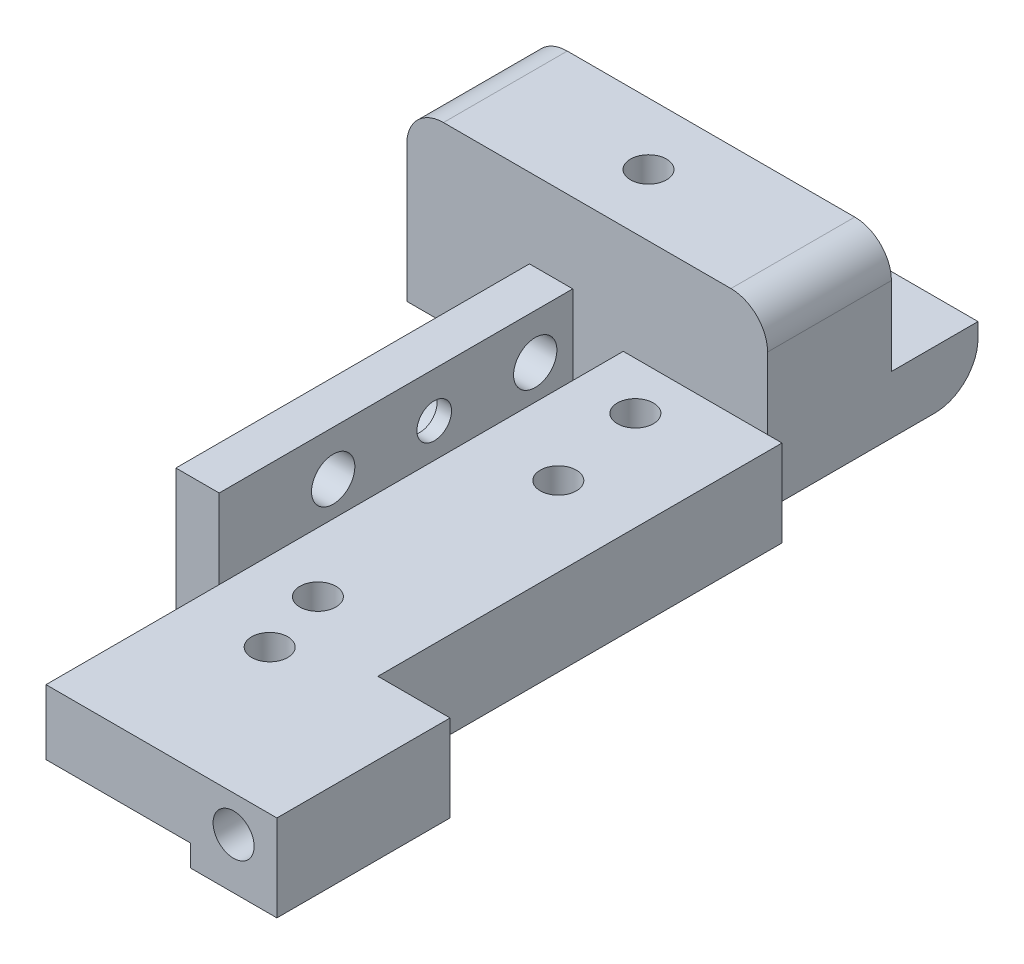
SolidWorks part; units mm, degrees
ref_plane "Front Plane" through (0, 0, 0) normal (0, 0, 1) x (1, 0, 0)
ref_plane "Top Plane" through (0, 0, 0) normal (0, 1, 0) x (1, 0, 0)
ref_plane "Right Plane" through (0, 0, 0) normal (1, 0, 0) x (0, 0, -1)
sketch "Sketch1" plane through (0, 0, 0) normal (0, 1, 0) x (1, 0, 0)
  line L0 (0, 0) -> (0, -40)
  line L1 (0, -40) -> (11, -40)
  line L2 (11, -40) -> (11, 0)
  line L5 (11, 0) -> (0, 0)
  dimension "D1" = 40
  dimension "D3" = 11
extrude "Boss-Extrude1" add sketch "Sketch1" along normal blind 4.5
sketch "Sketch2" plane through (0, 0, 0) normal (0, -1, 0) x (1, 0, 0)
  line L0 (11, 0) -> (0, 0) construction
  line L1 (10, 40) -> (11, 40)
  line L2 (10, 40) -> (10, 0)
  line L3 (10, 0) -> (11, 0)
  line L4 (11, 40) -> (11, 0)
  dimension "D1" = 1
extrude "Boss-Extrude2" add sketch "Sketch2" along normal blind 2
hole_wizard "M3x0.5 Tapped Hole1" positions "Sketch6" profile "Sketch5" tap size "M3x0.5" standard "ANSI Metric"
sketch "Sketch6" plane through (0, 0, 0) normal (0, -1, 0) x (-1, 0, 0)
  line L0 (-5.5, -40) -> (-5.5, 0) construction
  line L2 (-10, 0) -> (0, 0) construction
  line L3 (-10, 0) -> (0, 0) construction
  line L4 (0, -40) -> (-10, -40) construction
  line L5 (-10, -40) -> (-10, 0) construction
  point P0 (-5.5, -10)
  point P2 (-5.5, -30)
  dimension "D1" = 10
  dimension "D2" = 20
  dimension "D3" = 4.5
sketch "Sketch5" plane through (5.5, 0, 10) normal (1, 0, 0) x (0, 0, -1)
  line L0 (0, 0) -> (0, 9.2511)
  line L1 (0, 9.2511) -> (1.25, 8.5)
  line L2 (1.25, 8.5) -> (1.25, 0)
  line L5 (1.25, 0) -> (0, 0)
  line L10 (0, 9.2511) -> (-1.25, 8.5) construction
  line L11 (0, -6.35) -> (0, 107.95) construction
  dimension "Tap Drill Dia." = 2.5
  dimension "Tap Drill Depth" = 8.5
  dimension "Drill Angle" = 118
sketch "Sketch8" plane through (0, 0, 0) normal (0, 0, -1) x (-1, 0, 0)
  line L0 (-10, 0) -> (0, 0) construction
  line L1 (15, 0) -> (-10, 0)
  line L2 (15, 0) -> (15, 12)
  line L3 (15, 12) -> (-10, 12)
  line L4 (-11, 4.5) -> (-11, -2) construction
  line L6 (-10, 0) -> (-10, 12)
  dimension "D1" = 1
  dimension "D2" = 25
  dimension "D3" = 12
extrude "Boss-Extrude4" add sketch "Sketch8" along normal blind 8.58
hole_wizard "M3x0.5 Tapped Hole2" positions "Sketch10" profile "Sketch9" tap size "M3x0.5" standard "ANSI Metric"
sketch "Sketch10" plane through (0, 4.5, 0) normal (0, 1, 0) x (-1, 0, 0)
  line L0 (-4.14, 0) -> (-4.14, 40) construction
  line L1 (-10, 0) -> (0, 0) construction
  line L9 (-10, 40) -> (-10, 0) construction
  point P0 (-4.14, 3.3)
  point P2 (-4.14, 25.3)
  dimension "D1" = 3.3
  dimension "D2" = 22
  dimension "D3" = 5.86
sketch "Sketch9" plane through (4.14, 4.5, 3.3) normal (1, 0, 0) x (0, 0, 1)
  line L0 (0, 0) -> (0, 9.2511)
  line L1 (0, 9.2511) -> (1.25, 8.5)
  line L2 (1.25, 8.5) -> (1.25, 0)
  line L5 (1.25, 0) -> (0, 0)
  line L10 (0, 9.2511) -> (-1.25, 8.5) construction
  line L11 (0, -6.35) -> (0, 107.95) construction
  dimension "Tap Drill Dia." = 2.5
  dimension "Tap Drill Depth" = 8.5
  dimension "Drill Angle" = 118
sketch "Sketch11" plane through (0, 0, 0) normal (1, 0, 0) x (0, 0, -1)
  line L0 (-40, 4.5) -> (-40, -2) construction
  line L1 (-28, 0) -> (-3.5, 0)
  line L2 (-28, 0) -> (-28, 10)
  line L3 (-28, 10) -> (-3.5, 10)
  line L4 (-3.5, 0) -> (-3.5, 10)
  line L6 (-40, 0) -> (0, 0) construction
  line L7 (0, 12) -> (0, 4.5) construction
  dimension "D1" = 10
  dimension "D2" = 12
  dimension "D3" = 3.5
extrude "Boss-Extrude5" add sketch "Sketch11" against normal blind 3
sketch "Sketch12" plane through (0, 0, -8.58) normal (0, 0, -1) x (-1, 0, 0)
  line L0 (15, 0) -> (15, 12) construction
  line L1 (-10, 4) -> (15, 4)
  line L2 (-10, 4) -> (-10, 0)
  line L3 (-10, 0) -> (15, 0)
  line L4 (15, 4) -> (15, 0)
  line L6 (-10, 12) -> (-10, 0) construction
  line L7 (-10, 0) -> (15, 0) construction
  dimension "D1" = 4
extrude "Boss-Extrude6" add sketch "Sketch12" along normal blind 6
fillet "Fillet1" radius 3 1 edges at (-2.5, 0, -14.58)
hole_wizard "M3x0.5 Tapped Hole4" positions "Sketch17" profile "Sketch16" tap size "M3x0.5" standard "ANSI Metric"
sketch "Sketch17" plane through (0, 0, -8.58) normal (0, 0, -1) x (-1, 0, 0)
  line L0 (2.5, 12) -> (2.5, 0) construction
  line L1 (15, 12) -> (-10, 12) construction
  line L2 (15, 0) -> (-10, 0) construction
  line L4 (-10, 8) -> (-5.5, 8) construction
  line L6 (-10, 12) -> (-10, 4) construction
  point P0 (-5.5, 8)
  point P16 (10.5, 8)
  dimension "D1" = 16
sketch "Sketch16" plane through (5.5, 8, -8.58) normal (1, 0, 0) x (0, 1, 0)
  line L0 (0, 0) -> (0, 8.2511)
  line L1 (0, 8.2511) -> (1.25, 7.5)
  line L2 (1.25, 7.5) -> (1.25, 0)
  line L5 (1.25, 0) -> (0, 0)
  line L10 (0, 8.2511) -> (-1.25, 7.5) construction
  line L11 (0, -6.35) -> (0, 107.95) construction
  dimension "Tap Drill Dia." = 2.5
  dimension "Tap Drill Depth" = 7.5
  dimension "Drill Angle" = 118
sketch "Sketch18" plane through (0, 0, -8.58) normal (0, 0, -1) x (-1, 0, 0)
  line L0 (-5.5, 8) -> (10.5, 8) construction
  circle A0 centre (6.5, 8) radius 1.5
  circle A1 centre (-5.5, 8) radius 1.25 construction
  dimension "D1" = 3
  dimension "D2" = 12
extrude "Cut-Extrude1" [suppressed] cut sketch "Sketch18" against normal up to next
sketch "Sketch19" plane through (0, 4.5, 0) normal (0, 1, 0) x (1, 0, 0)
  line L0 (11, -40) -> (16, -40)
  line L1 (16, -40) -> (16, -28)
  line L2 (16, -28) -> (11, -28)
  line L3 (11, -40) -> (11, 0) construction
  line L4 (11, -28) -> (11, -40)
  dimension "D1" = 5
  dimension "D2" = 12
extrude "Boss-Extrude7" add sketch "Sketch19" against normal up to surface (6.5 mm away)
hole_wizard "#4-40 Tapped Hole1" positions "Sketch22" profile "Sketch21" tap size "#4-40" standard "ANSI Inch"
sketch "Sketch22" plane through (0, 0, 40) normal (0, 0, 1) x (1, 0, 0)
  line L1 (16, -2) -> (10, -2) construction
  line L2 (10, -2) -> (10, 0) construction
  point P0 (13, 2)
  dimension "D1" = 3
  dimension "D2" = 4
sketch "Sketch21" plane through (13, 2, 40) normal (1, 0, 0) x (0, -1, 0)
  line L0 (0, 0) -> (0, 9.5492)
  line L1 (0, 9.5492) -> (1.1303, 8.87)
  line L2 (1.1303, 8.87) -> (1.1303, 5.69)
  line L3 (1.1303, 5.69) -> (1.4224, 5.69)
  line L4 (1.4224, 5.69) -> (1.4224, 0)
  line L5 (1.4224, 0) -> (0, 0)
  line L10 (0, 9.5492) -> (-1.1303, 8.87) construction
  line L11 (0, -6.35) -> (0, 107.95) construction
  dimension "Tap Drill Dia." = 2.2606
  dimension "Tap Drill Depth" = 8.87
  dimension "Thread Major Dia." = 2.8448
  dimension "Thread Depth" = 5.69
  dimension "Drill Angle" = 118
sketch "Sketch23" plane through (0, 0, 28) normal (0, 0, -1) x (-1, 0, 0)
  line L0 (-16, -2) -> (-16, 4.5) construction
  line L1 (-16, 4.5) -> (-11, 4.5) construction
  circle A0 centre (-13.5, 2) radius 1.5875
  dimension "D1" = 3.175
  dimension "D2" = 2.5
  dimension "D3" = 2.5
extrude "Cut-Extrude3" cut sketch "Sketch23" against normal blind 3
hole_wizard "CBORE for M2 SHCS1" positions "Sketch25" profile "Sketch24" counterbore size "M2" standard "ANSI Metric"
sketch "Sketch25" plane through (-3, 0, 0) normal (-1, 0, 0) x (0, 0, 1)
  line L9 (0, -2) -> (0, 0) construction
  line L10 (40, -2) -> (0, -2) construction
  point P0 (13.1, 6.8812)
  dimension "D1" = 13.1
  dimension "D2" = 8.8812
sketch "Sketch24" plane through (-3, 6.8812, 13.1) normal (0, 1, 0) x (0, 0, 1)
  line L0 (0, 0) -> (0, 19)
  line L1 (0, 19) -> (1.2, 19)
  line L3 (1.2, 19) -> (1.2, 2)
  line L4 (1.2, 2) -> (2.2, 2)
  line L5 (2.2, 2) -> (2.2, 0)
  line L7 (2.2, 0) -> (0, 0)
  line L11 (0, -6.35) -> (0, 107.95) construction
  dimension "Thru Hole Dia." = 2.4
  dimension "Thru Hole Depth" = 19
  dimension "C'Bore Dia." = 4.4
  dimension "C'Bore Depth" = 2
hole_wizard "M3x0.5 Tapped Hole5" positions "Sketch27" profile "Sketch26" tap size "M3x0.5" standard "ANSI Metric"
sketch "Sketch27" plane through (-3, 0, 0) normal (-1, 0, 0) x (0, 0, 1)
  line L0 (13.1, 6.8812) -> (6.1, 6.8812) construction
  line L2 (13.1, 6.8812) -> (13.1, 10) construction
  line L3 (3.5, 10) -> (28, 10) construction
  point P0 (6.1, 6.8812)
  point P14 (20.1, 6.8812)
  dimension "D1" = 14
sketch "Sketch26" plane through (-3, 6.8812, 6.1) normal (0, 1, 0) x (0, 0, 1)
  line L0 (0, 0) -> (0, 19)
  line L1 (0, 19) -> (1.5, 19)
  line L2 (1.5, 19) -> (1.5, 0)
  line L5 (1.5, 0) -> (0, 0)
  line L11 (0, -6.35) -> (0, 107.95) construction
  dimension "Thread Major Dia." = 3
  dimension "Thru Tap Drill Depth" = 19
sketch "Sketch31" plane through (0, -2, 0) normal (0, -1, 0) x (1, 0, 0)
  line L6 (10, 40) -> (10, 0)
  line L7 (10, 0) -> (11, 0)
  line L8 (11, 0) -> (11, 28)
  line L9 (11, 28) -> (16, 28)
  line L10 (16, 28) -> (16, 40)
  line L11 (16, 40) -> (10, 40)
  line L12 (10, 40) -> (10, 0)
  line L13 (10, 0) -> (11, 0)
  line L14 (11, 0) -> (11, 28)
  line L15 (11, 28) -> (16, 28)
  line L16 (16, 28) -> (16, 40)
  line L17 (16, 40) -> (10, 40)
  dimension "D1" = 0
extrude "Cut-Extrude4" cut sketch "Sketch31" against normal blind 0.5
fillet "Fillet2" radius 2.54 2 edges at (-15, 12, -4.29) (10, 12, -4.29)
hole_wizard "M3x0.5 Tapped Hole7" positions "Sketch35" profile "Sketch34" tap size "M3x0.5" standard "ANSI Metric"
sketch "Sketch35" plane through (0, 12, 0) normal (0, 1, 0) x (1, 0, 0)
  line L0 (-2.54, 4.29) -> (7.46, 4.29) construction
  line L1 (7.46, 0) -> (7.46, 8.58) construction
  point P0 (-2.54, 4.29)
  dimension "D1" = 10
sketch "Sketch34" plane through (-2.54, 12, -4.29) normal (1, 0, 0) x (0, 0, 1)
  line L0 (0, 0) -> (0, 10.2511)
  line L1 (0, 10.2511) -> (1.25, 9.5)
  line L2 (1.25, 9.5) -> (1.25, 0)
  line L5 (1.25, 0) -> (0, 0)
  line L10 (0, 10.2511) -> (-1.25, 9.5) construction
  line L11 (0, -6.35) -> (0, 107.95) construction
  dimension "Tap Drill Dia." = 2.5
  dimension "Tap Drill Depth" = 9.5
  dimension "Drill Angle" = 118
